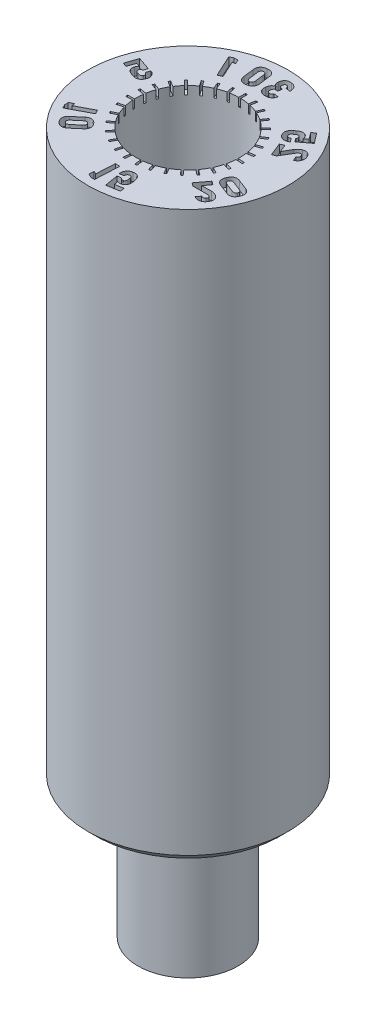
SolidWorks part; units mm, degrees
other "<M3L8-SetScrew>-<Chamfer1>" parameters "D10"=0.24
ref_plane "Front Plane" through (0, 0, 0) normal (0, 0, 1) x (1, 0, 0)
ref_plane "Top Plane" through (0, 0, 0) normal (0, 1, 0) x (1, 0, 0)
ref_plane "Right Plane" through (0, 0, 0) normal (1, 0, 0) x (0, 0, -1)
sketch "Sketch1" plane through (0, 0, 0) normal (0, 0, 1) x (1, 0, 0)
  line L0 (0, 0) -> (0, 20) construction
  line L1 (0, -11) -> (0, 11) construction
  line L2 (1.5, -17) -> (2.76, -17)
  line L4 (3, -16.76) -> (3, 0)
  line L5 (3, 0) -> (1.55, 0)
  line L6 (1.55, 0) -> (1.55, -2.8)
  line L7 (1.55, -2.8) -> (0.8, -2.8)
  line L8 (0.8, -2.8) -> (0.8, -13)
  line L9 (0.8, -13) -> (1.5, -13)
  line L10 (1.5, -13) -> (1.5, -17)
  line L11 (2.76, -17) -> (3, -16.76)
  point P6 (3, -17)
  dimension "D1" = 2.8
  dimension "D2" = 4
  dimension "D3" = 1.6
  dimension "D4" = 3.1
  dimension "D5" = 6
  dimension "D6" = 3
  dimension "D7" = 17
revolve "Revolve1" add sketch "Sketch1" angle 360 about L0
sketch "Sketch2" plane through (0, 0, 0) normal (0, 1, 0) x (1, 0, 0)
  line L0 (0, 0) -> (0, 2.1482) construction
  line L1 (0.3816, 1.7079) -> (0.3413, 1.5119)
  line L2 (-0.03, 1.7497) -> (0.03, 1.7497)
  line L3 (-0.03, 1.7497) -> (-0.03, 1.5497)
  line L4 (0.3228, 1.7199) -> (0.3816, 1.7079)
  line L5 (0.03, 1.7497) -> (0.03, 1.5497)
  line L6 (0.3228, 1.7199) -> (0.2826, 1.524)
  line L7 (0.7176, 1.5961) -> (0.6387, 1.4123)
  line L8 (0.6624, 1.6197) -> (0.7176, 1.5961)
  line L9 (0.6624, 1.6197) -> (0.5836, 1.4359)
  line L10 (1.0242, 1.419) -> (0.9099, 1.2548)
  line L11 (0.9749, 1.4532) -> (1.0242, 1.419)
  line L12 (0.9749, 1.4532) -> (0.8607, 1.2891)
  line L13 (1.2888, 1.1837) -> (1.1439, 1.046)
  line L14 (1.2475, 1.2272) -> (1.2888, 1.1837)
  line L15 (1.2475, 1.2272) -> (1.1025, 1.0894)
  line L16 (1.5007, 0.9001) -> (1.331, 0.7943)
  line L17 (1.469, 0.951) -> (1.5007, 0.9001)
  line L18 (1.469, 0.951) -> (1.2993, 0.8452)
  line L19 (1.6512, 0.5796) -> (1.4637, 0.5101)
  line L20 (1.6304, 0.6358) -> (1.6512, 0.5796)
  line L21 (1.6304, 0.6358) -> (1.4428, 0.5664)
  line L22 (1.7341, 0.2353) -> (1.5364, 0.205)
  line L23 (1.725, 0.2946) -> (1.7341, 0.2353)
  line L24 (1.725, 0.2946) -> (1.5273, 0.2643)
  line L25 (1.7459, -0.1186) -> (1.5462, -0.1085)
  line L26 (1.749, -0.0587) -> (1.7459, -0.1186)
  line L27 (1.749, -0.0587) -> (1.5492, -0.0485)
  line L28 (1.6863, -0.4676) -> (1.4927, -0.4175)
  line L29 (1.7014, -0.4095) -> (1.6863, -0.4676)
  line L30 (1.7014, -0.4095) -> (1.5078, -0.3594)
  line L31 (1.5577, -0.7975) -> (1.3781, -0.7094)
  line L32 (1.5841, -0.7436) -> (1.5577, -0.7975)
  line L33 (1.5841, -0.7436) -> (1.4045, -0.6555)
  line L34 (1.3653, -1.0947) -> (1.2071, -0.9723)
  line L35 (1.402, -1.0473) -> (1.3653, -1.0947)
  line L36 (1.402, -1.0473) -> (1.2438, -0.9249)
  line L37 (1.1169, -1.3471) -> (0.9867, -1.1954)
  line L38 (1.1625, -1.3081) -> (1.1169, -1.3471)
  line L39 (1.1625, -1.3081) -> (1.0322, -1.1563)
  line L40 (0.8229, -1.5444) -> (0.7258, -1.3695)
  line L41 (0.8754, -1.5153) -> (0.8229, -1.5444)
  line L42 (0.8754, -1.5153) -> (0.7783, -1.3404)
  line L43 (0.4952, -1.6784) -> (0.4353, -1.4876)
  line L44 (0.5524, -1.6605) -> (0.4952, -1.6784)
  line L45 (0.5524, -1.6605) -> (0.4926, -1.4697)
  line L46 (0.1472, -1.7438) -> (0.1269, -1.5448)
  line L47 (0.2069, -1.7377) -> (0.1472, -1.7438)
  line L48 (0.2069, -1.7377) -> (0.1866, -1.5387)
  line L49 (-0.2069, -1.7377) -> (-0.1866, -1.5387)
  line L50 (-0.1472, -1.7438) -> (-0.2069, -1.7377)
  line L51 (-0.1472, -1.7438) -> (-0.1269, -1.5448)
  line L52 (-0.5524, -1.6605) -> (-0.4926, -1.4697)
  line L53 (-0.4952, -1.6784) -> (-0.5524, -1.6605)
  line L54 (-0.4952, -1.6784) -> (-0.4353, -1.4876)
  line L55 (-0.8754, -1.5153) -> (-0.7783, -1.3404)
  line L56 (-0.8229, -1.5444) -> (-0.8754, -1.5153)
  line L57 (-0.8229, -1.5444) -> (-0.7258, -1.3695)
  line L58 (-1.1625, -1.3081) -> (-1.0322, -1.1563)
  line L59 (-1.1169, -1.3471) -> (-1.1625, -1.3081)
  line L60 (-1.1169, -1.3471) -> (-0.9867, -1.1954)
  line L61 (-1.402, -1.0473) -> (-1.2438, -0.9249)
  line L62 (-1.3653, -1.0947) -> (-1.402, -1.0473)
  line L63 (-1.3653, -1.0947) -> (-1.2071, -0.9723)
  line L64 (-1.5841, -0.7436) -> (-1.4045, -0.6555)
  line L65 (-1.5577, -0.7975) -> (-1.5841, -0.7436)
  line L66 (-1.5577, -0.7975) -> (-1.3781, -0.7094)
  line L67 (-1.7014, -0.4095) -> (-1.5078, -0.3594)
  line L68 (-1.6863, -0.4676) -> (-1.7014, -0.4095)
  line L69 (-1.6863, -0.4676) -> (-1.4927, -0.4175)
  line L70 (-1.749, -0.0587) -> (-1.5492, -0.0485)
  line L71 (-1.7459, -0.1186) -> (-1.749, -0.0587)
  line L72 (-1.7459, -0.1186) -> (-1.5462, -0.1085)
  line L73 (-1.725, 0.2946) -> (-1.5273, 0.2643)
  line L74 (-1.7341, 0.2353) -> (-1.725, 0.2946)
  line L75 (-1.7341, 0.2353) -> (-1.5364, 0.205)
  line L76 (-1.6304, 0.6358) -> (-1.4428, 0.5664)
  line L77 (-1.6512, 0.5796) -> (-1.6304, 0.6358)
  line L78 (-1.6512, 0.5796) -> (-1.4637, 0.5101)
  line L79 (-1.469, 0.951) -> (-1.2993, 0.8452)
  line L80 (-1.5007, 0.9001) -> (-1.469, 0.951)
  line L81 (-1.5007, 0.9001) -> (-1.331, 0.7943)
  line L82 (-1.2475, 1.2272) -> (-1.1025, 1.0894)
  line L83 (-1.2888, 1.1837) -> (-1.2475, 1.2272)
  line L84 (-1.2888, 1.1837) -> (-1.1439, 1.046)
  line L85 (-0.9749, 1.4532) -> (-0.8607, 1.2891)
  line L86 (-1.0242, 1.419) -> (-0.9749, 1.4532)
  line L87 (-1.0242, 1.419) -> (-0.9099, 1.2548)
  line L88 (-0.6624, 1.6197) -> (-0.5836, 1.4359)
  line L89 (-0.7176, 1.5961) -> (-0.6624, 1.6197)
  line L90 (-0.7176, 1.5961) -> (-0.6387, 1.4123)
  line L91 (-0.3228, 1.7199) -> (-0.2826, 1.524)
  line L92 (-0.3816, 1.7079) -> (-0.3228, 1.7199)
  line L93 (-0.3816, 1.7079) -> (-0.3413, 1.5119)
  line L94 (0, 0) -> (1.8604, 1.0741) construction
  line L95 (0, 0) -> (1.8604, -1.0741) construction
  line L96 (0, 0) -> (0, -2.1482) construction
  line L97 (0, 0) -> (-1.8604, -1.0741) construction
  line L98 (0, 0) -> (-1.8604, 1.0741) construction
  circle A0 centre (0, 0) radius 2.03 construction
  arc A1 (0.03, 1.5497) -> (-0.03, 1.5497) centre (0, 0) ccw
  circle A2 centre (0, 0) radius 0.8 construction
  arc A3 (0.3413, 1.5119) -> (0.2826, 1.524) centre (0, 0) ccw
  arc A4 (0.6387, 1.4123) -> (0.5836, 1.4359) centre (0, 0) ccw
  arc A5 (0.9099, 1.2548) -> (0.8607, 1.2891) centre (0, 0) ccw
  arc A6 (1.1439, 1.046) -> (1.1025, 1.0894) centre (0, 0) ccw
  arc A7 (1.331, 0.7943) -> (1.2993, 0.8452) centre (0, 0) ccw
  arc A8 (1.4637, 0.5101) -> (1.4428, 0.5664) centre (0, 0) ccw
  arc A9 (1.5364, 0.205) -> (1.5273, 0.2643) centre (0, 0) ccw
  arc A10 (1.5462, -0.1085) -> (1.5492, -0.0485) centre (0, 0) ccw
  arc A11 (1.4927, -0.4175) -> (1.5078, -0.3594) centre (0, 0) ccw
  arc A12 (1.3781, -0.7094) -> (1.4045, -0.6555) centre (0, 0) ccw
  arc A13 (1.2071, -0.9723) -> (1.2438, -0.9249) centre (0, 0) ccw
  arc A14 (0.9867, -1.1954) -> (1.0322, -1.1563) centre (0, 0) ccw
  arc A15 (0.7258, -1.3695) -> (0.7783, -1.3404) centre (0, 0) ccw
  arc A16 (0.4353, -1.4876) -> (0.4926, -1.4697) centre (0, 0) ccw
  arc A17 (0.1269, -1.5448) -> (0.1866, -1.5387) centre (0, 0) ccw
  arc A18 (-0.1866, -1.5387) -> (-0.1269, -1.5448) centre (0, 0) ccw
  arc A19 (-0.4926, -1.4697) -> (-0.4353, -1.4876) centre (0, 0) ccw
  arc A20 (-0.7783, -1.3404) -> (-0.7258, -1.3695) centre (0, 0) ccw
  arc A21 (-1.0322, -1.1563) -> (-0.9867, -1.1954) centre (0, 0) ccw
  arc A22 (-1.2438, -0.9249) -> (-1.2071, -0.9723) centre (0, 0) ccw
  arc A23 (-1.4045, -0.6555) -> (-1.3781, -0.7094) centre (0, 0) ccw
  arc A24 (-1.5078, -0.3594) -> (-1.4927, -0.4175) centre (0, 0) ccw
  arc A25 (-1.5492, -0.0485) -> (-1.5462, -0.1085) centre (0, 0) ccw
  arc A26 (-1.5273, 0.2643) -> (-1.5364, 0.205) centre (0, 0) ccw
  arc A27 (-1.4428, 0.5664) -> (-1.4637, 0.5101) centre (0, 0) ccw
  arc A28 (-1.2993, 0.8452) -> (-1.331, 0.7943) centre (0, 0) ccw
  arc A29 (-1.1025, 1.0894) -> (-1.1439, 1.046) centre (0, 0) ccw
  arc A30 (-0.8607, 1.2891) -> (-0.9099, 1.2548) centre (0, 0) ccw
  arc A31 (-0.5836, 1.4359) -> (-0.6387, 1.4123) centre (0, 0) ccw
  arc A32 (-0.2826, 1.524) -> (-0.3413, 1.5119) centre (0, 0) ccw
  text T0 "   25      30 1       5       10       15      20" font "Bahnschrift" height 0.72
  point P17 (0, 0)
  point P135 (0, 0)
  point P140 (0, 0)
  dimension "D1" = 4.06
  dimension "D4" = 1.5497
  dimension "D7" = 0.75
  dimension "D2" = 0.06
  dimension "D3" = 0.03
  dimension "D5" = 1.55
  dimension "D6" = 0.2
  dimension "D8" = 31
  dimension "D9" = 6
extrude "Cut-Extrude1" cut sketch "Sketch2" against normal blind 0.25
inserted part "M3L8-SetScrew"
move or copy body "Body-Move/Copy2" placed by mates yes
other "Distance1" parameters "D1"=4
